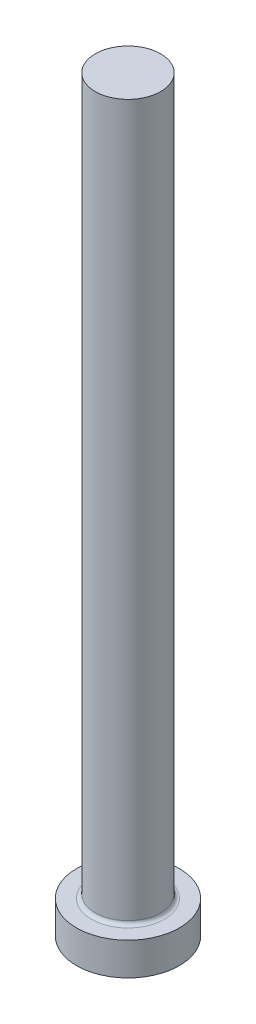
SolidWorks part; units mm, degrees
ref_plane "Plano frontal" through (0, 0, 0) normal (0, 0, 1) x (1, 0, 0)
ref_plane "Plano superior" through (0, 0, 0) normal (0, 1, 0) x (1, 0, 0)
ref_plane "Plano direito" through (0, 0, 0) normal (1, 0, 0) x (0, 0, -1)
sketch "Esboço1" plane through (0, 0, 0) normal (0, 0, 1) x (1, 0, 0)
  line L0 (0, 0) -> (11, 0)
  line L1 (11, 0) -> (11, 7)
  line L2 (11, 7) -> (7.8, 7)
  line L3 (7, 7.8) -> (7, 160)
  line L4 (7, 160) -> (0, 160)
  line L5 (0, 160) -> (0, 0) construction
  line L6 (0, 0) -> (0, 160)
  arc A0 (7.8, 7) -> (7, 7.8) centre (7.8, 7.8) cw
  dimension "D3" = 0.8
  dimension "D1" = 22
  dimension "D2" = 14
  dimension "D4" = 7
  dimension "D5" = 160
revolve "Revolução1" add sketch "Esboço1" angle 360 about L5
sketch "Esboço2"
  dimension "D1" = 0.825
  dimension "D2" = 1.925
  dimension "D3" = 1.2375
  dimension "D4" = 5.9125
wrap "Envolver1" sketch "Esboço2" source sketch "Esboço2" thickness 0.1 parameters "D1"=0.1
